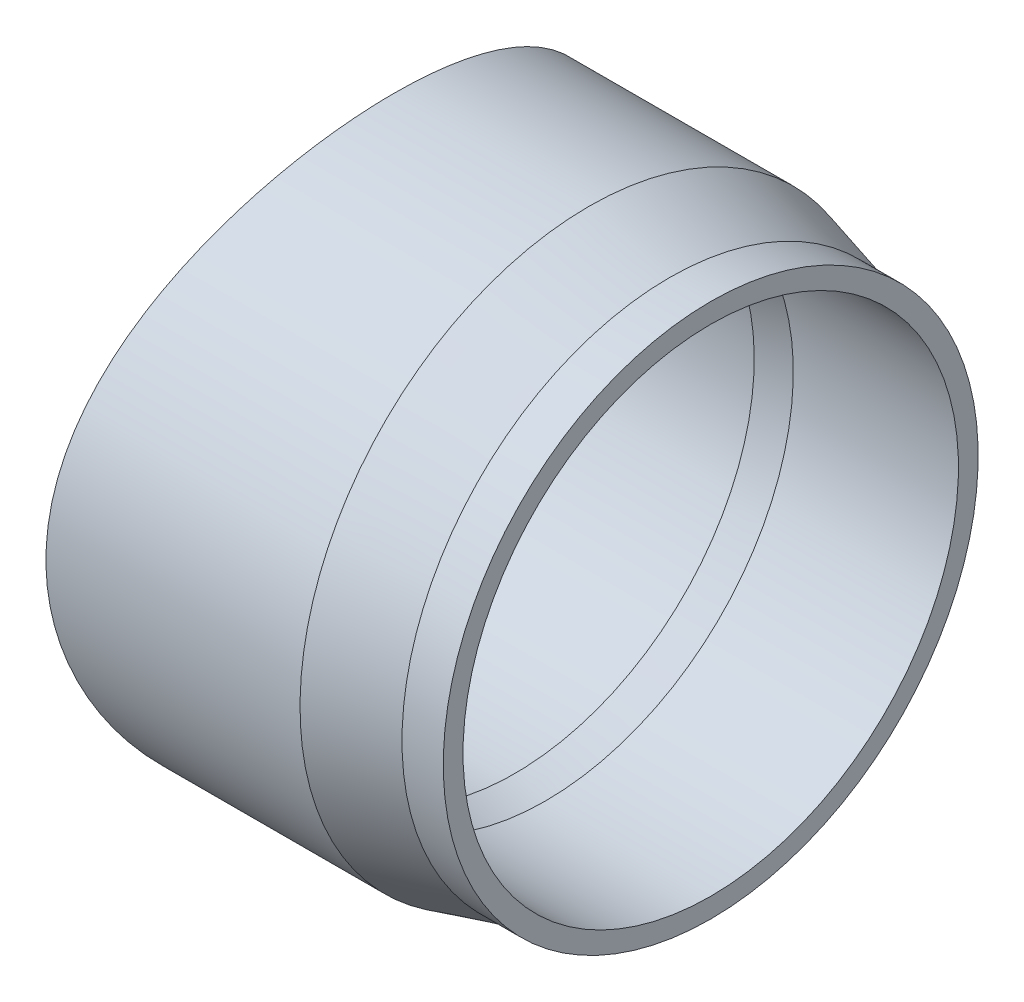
SolidWorks part; units mm, degrees
ref_plane "Ebene vorne" through (0, 0, 0) normal (0, 0, 1) x (1, 0, 0)
ref_plane "Ebene oben" through (0, 0, 0) normal (0, 1, 0) x (1, 0, 0)
ref_plane "Ebene rechts" through (0, 0, 0) normal (1, 0, 0) x (0, 0, -1)
sketch "Skizze3" plane through (0, 0, 0) normal (0, 0, 1) x (1, 0, 0)
  line L0 (561.3259, 0) -> (0, 0) construction
  line L2 (0, 0) -> (0, 350.1492) construction
  line L3 (522, 161.95) -> (497, 161.95)
  line L4 (497, 161.95) -> (448.2967, 175)
  line L5 (448.2967, 175) -> (222, 175)
  line L6 (222, 175) -> (222, 0)
  line L8 (222, 0) -> (522, 0)
  line L9 (522, 0) -> (522, 161.95)
  dimension "D1" = 323.9
  dimension "D2" = 522
  dimension "D3" = 25
  dimension "D4" = 15
  dimension "D5" = 300
  dimension "D6" = 350
revolve "Rotation1" add sketch "Skizze3" angle 360 about L0
sketch "Skizze5" plane through (522, 0, 0) normal (1, 0, 0) x (0, 0, -1)
  circle A0 centre (0, 0) radius 150
  dimension "D1" = 300
extrude "Schnitt-Linear austragen2" cut sketch "Skizze5" against normal blind 100
sketch "Skizze6" plane through (422, 0, 0) normal (1, 0, 0) x (0, 0, -1)
  circle A1 centre (0, 0) radius 150
  circle A2 centre (0, 0) radius 150
  dimension "D1" = 0
extrude "Schnitt-Linear austragen3" cut sketch "Skizze6" against normal blind 30 draft 15
sketch "Skizze7" plane through (522, 0, 0) normal (1, 0, 0) x (0, 0, -1)
  circle A0 centre (0, 0) radius 145
  dimension "D1" = 290
extrude "Schnitt-Linear austragen4" cut sketch "Skizze7" against normal through all
sketch "Skizze11" plane through (0, 0, 0) normal (0, 1, 0) x (1, 0, 0)
  circle A0 centre (0, 0) radius 315
  dimension "D1" = 630
extrude "Schnitt-Linear austragen5" cut sketch "Skizze11" against normal through all and the other way through all
chamfer "Fase2" distance 15 angle 60 2 edges at (314.991, -174.9839, 2.377) (314.5245, -143.9642, 17.3006)
